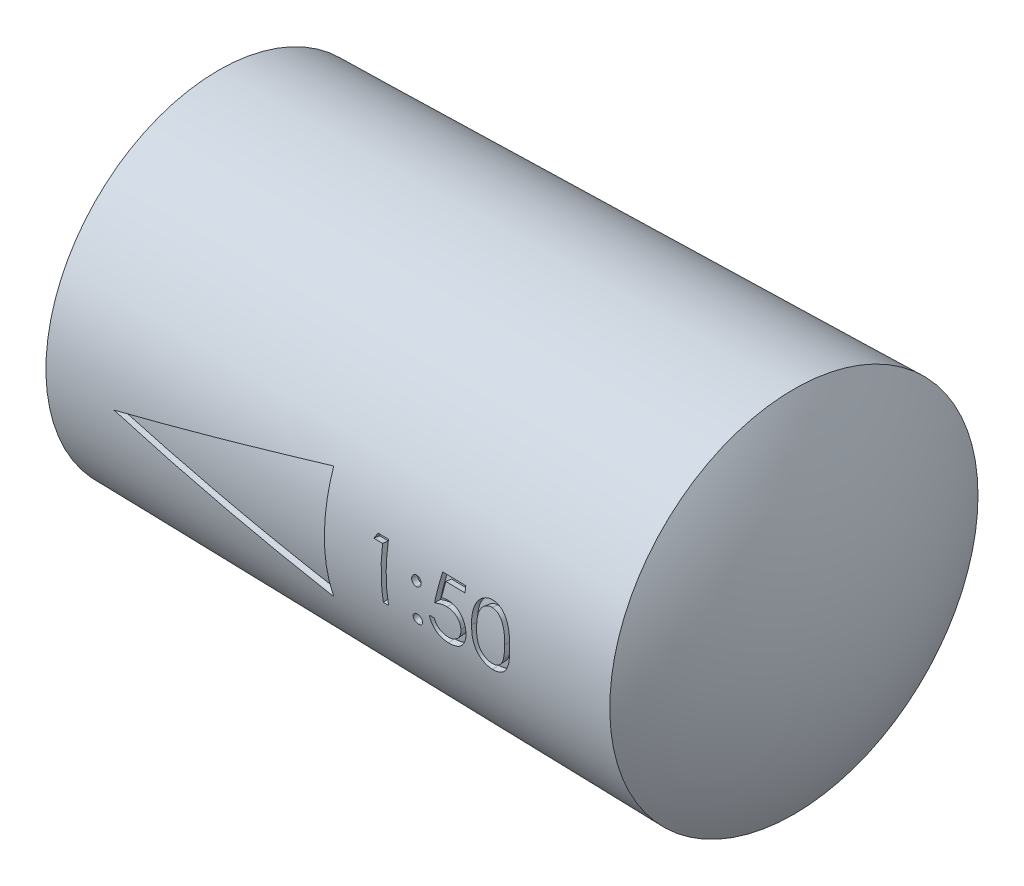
SolidWorks part; units mm, degrees
ref_plane "Front Plane" through (0, 0, 0) normal (0, 0, 1) x (1, 0, 0)
ref_plane "Top Plane" through (0, 0, 0) normal (0, 1, 0) x (1, 0, 0)
ref_plane "Right Plane" through (0, 0, 0) normal (1, 0, 0) x (0, 0, -1)
sketch "Sketch1" plane through (0, 0, 0) normal (1, 0, 0) x (0, 0, -1)
  circle A0 centre (0, 0) radius 3
  dimension "D1" = 6
extrude "Extrude1" add sketch "Sketch1" along normal mid plane 10
draft "Draft1" type of draft neutral plane draft angle 1.146 faces to draft 1 parameters "D1"=1.146
sketch "Sketch2" plane through (0, 0, 0) normal (0, 0, 1) x (1, 0, 0)
  line L0 (-5, 0) -> (-5, 3)
  line L1 (-5, 3) -> (-5, -3) construction
  line L2 (-5, 0) -> (-5.9, 0)
  line L3 (-5.9, 0) -> (-5.9, -3.1) construction
  line L4 (5, 0) -> (5, 3.2)
  line L5 (5, -3.2) -> (5, 3.2) construction
  line L6 (5, 0) -> (5.9, 0)
  line L7 (5.9, 0) -> (5.9, -3.1) construction
  line L8 (-5, -3) -> (5, -3.2) construction
  arc A0 (-5.9, 0) -> (-5, 3) centre (-0.45, 0) cw
  arc A1 (5.9, 0) -> (5, 3.2) centre (-0.2389, 0) ccw
  point P14 (0, -3.1)
revolve "Revolve1" add sketch "Sketch2" angle 360 about L2
sketch "Sketch5" plane through (0, 0, 0) normal (0, 0, 1) x (1, 0, 0)
  line L0 (0, 3.1) -> (0, -3.1) construction
  line L1 (5, 3.2) -> (-5, 3) construction
  line L2 (-5, -3) -> (5, -3.2) construction
ref_plane "Plane2" through (0, 0, 0) normal (-0.02, 0, 0.9998) x (0.9998, 0, 0.02)
sketch "Sketch6" plane through (0, 0, 0) normal (-0.02, 0, 0.9998) x (0.9998, 0, 0.02)
  line L0 (0, 0) -> (0, 1)
  line L1 (0, 3.1) -> (0, -3.1) construction
  line L2 (0, 1) -> (-3.7321, 0)
  line L3 (-3.7321, 0) -> (0, -1)
  line L4 (0, -1) -> (0, 0)
  line L5 (0, -0.5) -> (4, -0.5) construction
  text T0 "1:50" font "Century Gothic" height 1
  dimension "D1" = 2
  dimension "D2" = 30
  dimension "D3" = 4
wrap "Wrap2" sketch "Sketch6" wrap type deboss source sketch "Sketch6" thickness 0.1 parameters "D1"=0.1
equation "\"D2@Sketch2\" = \"D1@Sketch2\""
